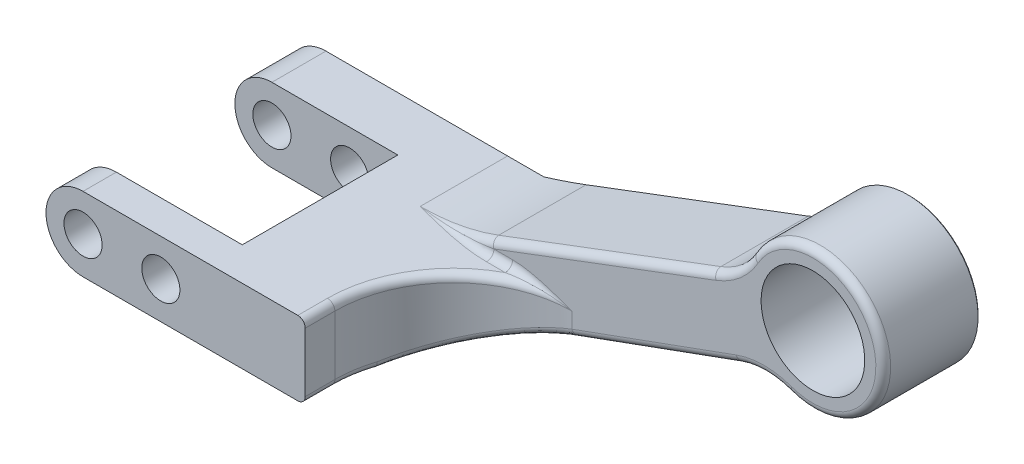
SolidWorks part; units mm, degrees
other "<IdlerLever>-<Fillet11>"
ref_plane "Front Plane" through (0, 0, 0) normal (0, 0, 1) x (1, 0, 0)
ref_plane "Top Plane" through (0, 0, 0) normal (0, 1, 0) x (1, 0, 0)
ref_plane "Right Plane" through (0, 0, 0) normal (1, 0, 0) x (0, 0, -1)
mirrored part "IdlerLever_Mirrored"
